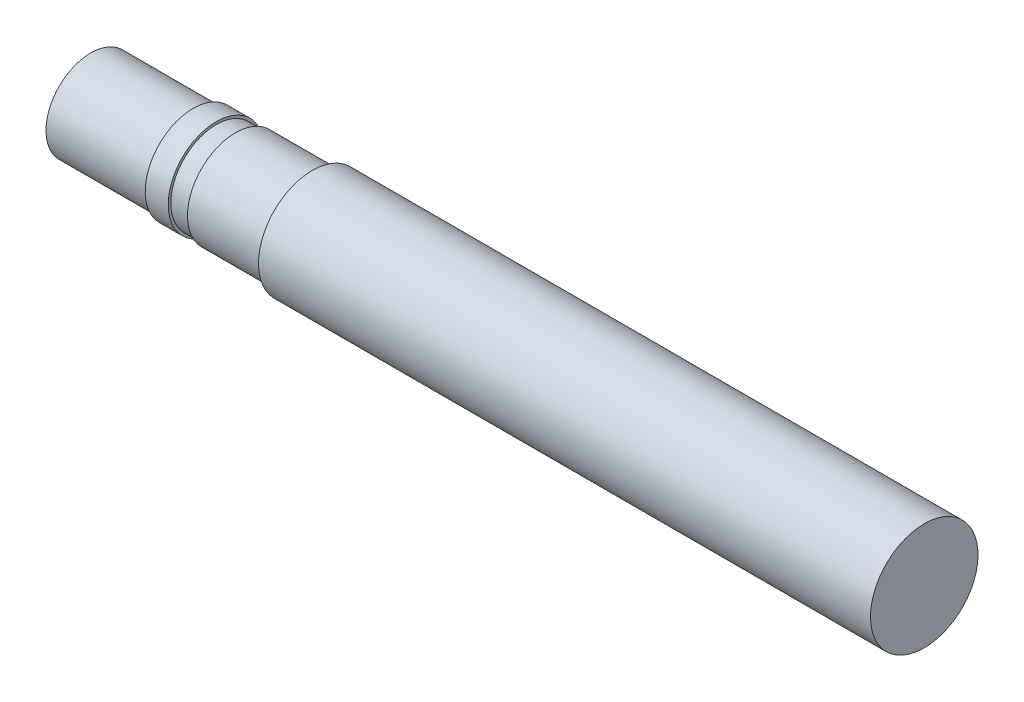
SolidWorks part; units mm, degrees
ref_plane "Front Plane" through (0, 0, 0) normal (0, 0, 1) x (1, 0, 0)
ref_plane "Top Plane" through (0, 0, 0) normal (0, 1, 0) x (1, 0, 0)
ref_plane "Right Plane" through (0, 0, 0) normal (1, 0, 0) x (0, 0, -1)
sketch "Sketch1" plane through (0, 0, 0) normal (0, 0, 1) x (1, 0, 0)
  line L0 (-571, 37.5) -> (-553, 37.5)
  line L1 (-478, 37.5) -> (-478, 42)
  line L2 (-478, 42) -> (0, 42)
  line L3 (0, 42) -> (0, 0)
  line L4 (0, 0) -> (-651, 0)
  line L5 (-571, 35) -> (-571, 37.5)
  line L6 (-571, 35) -> (-651, 35)
  line L7 (-651, 35) -> (-651, 0)
  line L8 (-553, 37.5) -> (-553, 35.5)
  line L9 (-553, 35.5) -> (-538, 35.5)
  line L10 (-538, 35.5) -> (-538, 37.5)
  line L11 (-538, 37.5) -> (-478, 37.5)
  dimension "D1" = 93
  dimension "D2" = 651
  dimension "D3" = 42
  dimension "D4" = 37.5
  dimension "D5" = 80
  dimension "D6" = 35
  dimension "D7" = 18
  dimension "D8" = 15
  dimension "D9" = 2
revolve "Revolve1" add sketch "Sketch1" angle 360 about L4
